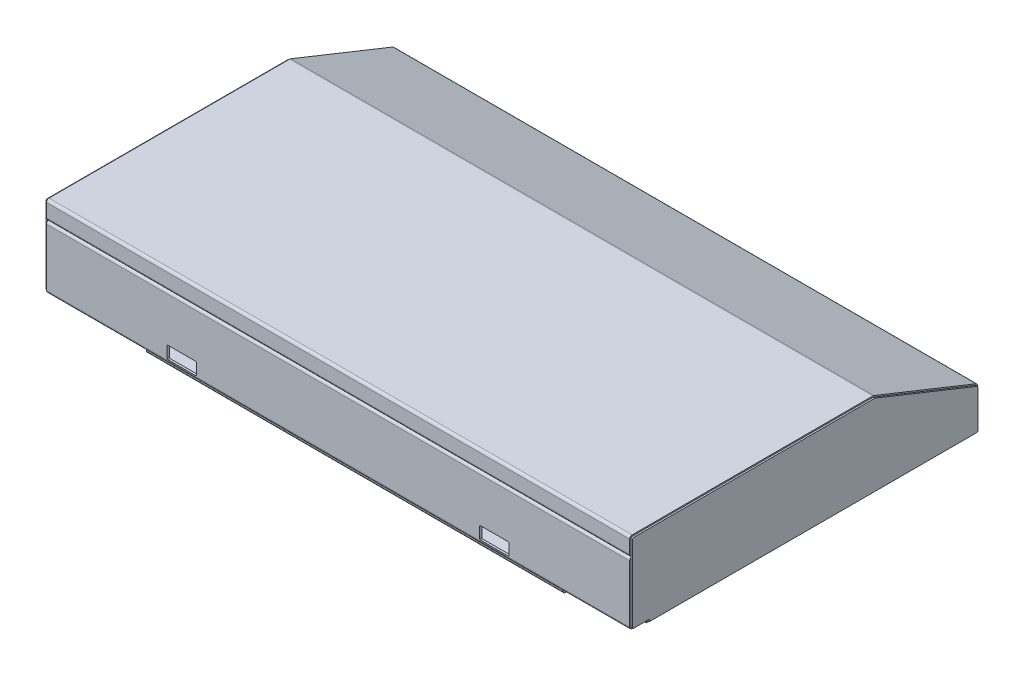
SolidWorks part; units mm, degrees
ref_plane "Front Plane" through (0, 0, 0) normal (0, 0, 1) x (1, 0, 0)
ref_plane "Top Plane" through (0, 0, 0) normal (0, 1, 0) x (1, 0, 0)
ref_plane "Right Plane" through (0, 0, 0) normal (1, 0, 0) x (0, 0, -1)
sketch "Sketch1" plane through (0, 0, 0) normal (1, 0, 0) x (0, 0, -1)
  line L0 (-30, 0) -> (0, 0)
  line L1 (-30, 0) -> (-30, -150)
  line L3 (804.985, -155) -> (804.985, -55)
  line L4 (804.985, -55) -> (554.985, 45)
  line L5 (554.985, 45) -> (-30, 45)
  line L6 (-30, 45) -> (-30, 1)
  line L7 (-30, 1) -> (0, 1)
  line L8 (-30, -150) -> (10, -150)
  line L10 (10, -155) -> (804.985, -155)
  line L12 (10, -150) -> (10, -155)
  line L13 (0, 1) -> (0, 0)
  dimension "D1" = 1
  dimension "D2" = 150
  dimension "D3" = 835
  dimension "D4" = 100
  dimension "D5" = 40
  dimension "D6" = 250
  dimension "D7" = 30
  dimension "D8" = 5
  dimension "D9" = 200
extrude "Boss-Extrude2" add sketch "Sketch1" along normal mid plane 1400
sketch "Sketch5" plane through (0, -155, 0) normal (0, -1, 0) x (1, 0, 0)
  line L0 (700, -10) -> (-700, -10) construction
  line L1 (500, -10) -> (-500, -10)
  line L2 (500, -10) -> (500, -510)
  line L3 (500, -510) -> (-500, -510)
  line L4 (-500, -10) -> (-500, -510)
  line L5 (0, -510) -> (0, -804.985) construction
  line L6 (700, -804.985) -> (-700, -804.985) construction
  dimension "D1" = 1000
  dimension "D2" = 500
extrude "Boss-Extrude3" add sketch "Sketch5" along normal blind 40
fillet "Fillet1" radius 6 10 edges at (0, 45, -554.985) (0, -55, -804.985) (0, -155, -804.985) (0, -155, -510) (0, -195, -510) (0, -195, -10) (0, 0, 30) (0, 1, 30) (0, -150, 30) (0, 45, 30)
shell "Shell1" thickness 5
sketch "Sketch6" plane through (0, 0, 30) normal (0, 0, 1) x (1, 0, 0)
  line L0 (-340, -112) -> (340, -112)
  line L1 (-410, -112) -> (-340, -112)
  line L2 (-410, -112) -> (-410, -142)
  line L3 (-410, -142) -> (-340, -142)
  line L4 (-340, -112) -> (-340, -142)
  line L5 (340, -112) -> (410, -112)
  line L6 (340, -112) -> (340, -142)
  line L7 (340, -142) -> (410, -142)
  line L8 (410, -112) -> (410, -142)
  line L9 (0, -112) -> (0, 39) construction
  line L10 (700, 39) -> (-700, 39) construction
  line L11 (700, -150) -> (-700, -150) construction
  dimension "D1" = 70
  dimension "D2" = 30
  dimension "D3" = 820
  dimension "D4" = 8
extrude "Cut-Extrude1" cut sketch "Sketch6" against normal blind 100 contours L4 L1 L2 L3 | L8 L5 L6 L7
fillet "Fillet2" radius 2 8 edges at (340, -112, 27.5) (340, -142, 27.5) (410, -142, 27.5) (410, -112, 27.5) (-340, -112, 27.5) (-340, -142, 27.5) (-410, -142, 27.5) (-410, -112, 27.5)
sketch "Sketch8" plane through (-700, 0, 0) normal (-1, 0, 0) x (0, 0, 1)
  line L7 (27, 7) -> (27, -144)
  line L9 (-13, -152) -> (-13, -147)
  line L10 (24, -147) -> (-10, -147)
  line L11 (24, -147) -> (-13, -147)
  line L12 (-10, -150) -> (-10, -155) construction
  line L13 (24, 4) -> (0, 4)
  line L14 (27, 39) -> (27, 7)
  line L15 (-10, -152) -> (-798.985, -152)
  line L16 (-801.985, -149) -> (-801.985, -59.0622)
  line L17 (-800.0992, -56.2768) -> (-554.9437, 41.7854)
  line L18 (-553.8295, 42) -> (24, 42)
  line L20 (27, 39) -> (27, 7)
  line L21 (-13, -152) -> (-798.985, -152)
  line L22 (-801.985, -149) -> (-801.985, -59.0622)
  line L23 (-800.0992, -56.2768) -> (-554.9437, 41.7854)
  line L24 (-553.8295, 42) -> (24, 42)
  arc A7 (24, -147) -> (27, -144) centre (24, -144) ccw
  arc A8 (24, -147) -> (27, -144) centre (24, -144) ccw
  arc A10 (24, 4) -> (27, 7) centre (24, 7) ccw
  arc A11 (27, 39) -> (24, 42) centre (24, 39) ccw
  arc A12 (-801.985, -149) -> (-798.985, -152) centre (-798.985, -149) ccw
  arc A13 (-800.0992, -56.2768) -> (-801.985, -59.0622) centre (-798.985, -59.0622) ccw
  arc A14 (-553.8295, 42) -> (-554.9437, 41.7854) centre (-553.8295, 39) ccw
  arc A16 (27, 39) -> (24, 42) centre (24, 39) ccw
  arc A17 (-801.985, -149) -> (-798.985, -152) centre (-798.985, -149) ccw
  arc A18 (-800.0992, -56.2768) -> (-801.985, -59.0622) centre (-798.985, -59.0622) ccw
  arc A19 (-553.8295, 42) -> (-554.9437, 41.7854) centre (-553.8295, 39) ccw
  dimension "D3" = 3
  dimension "D1" = 3
  dimension "D2" = 3
extrude "Boss-Extrude4" add sketch "Sketch8" along normal blind 4 separate body
mirror "Mirror2" about plane through (0, 0, 0) normal (1, 0, 0)
